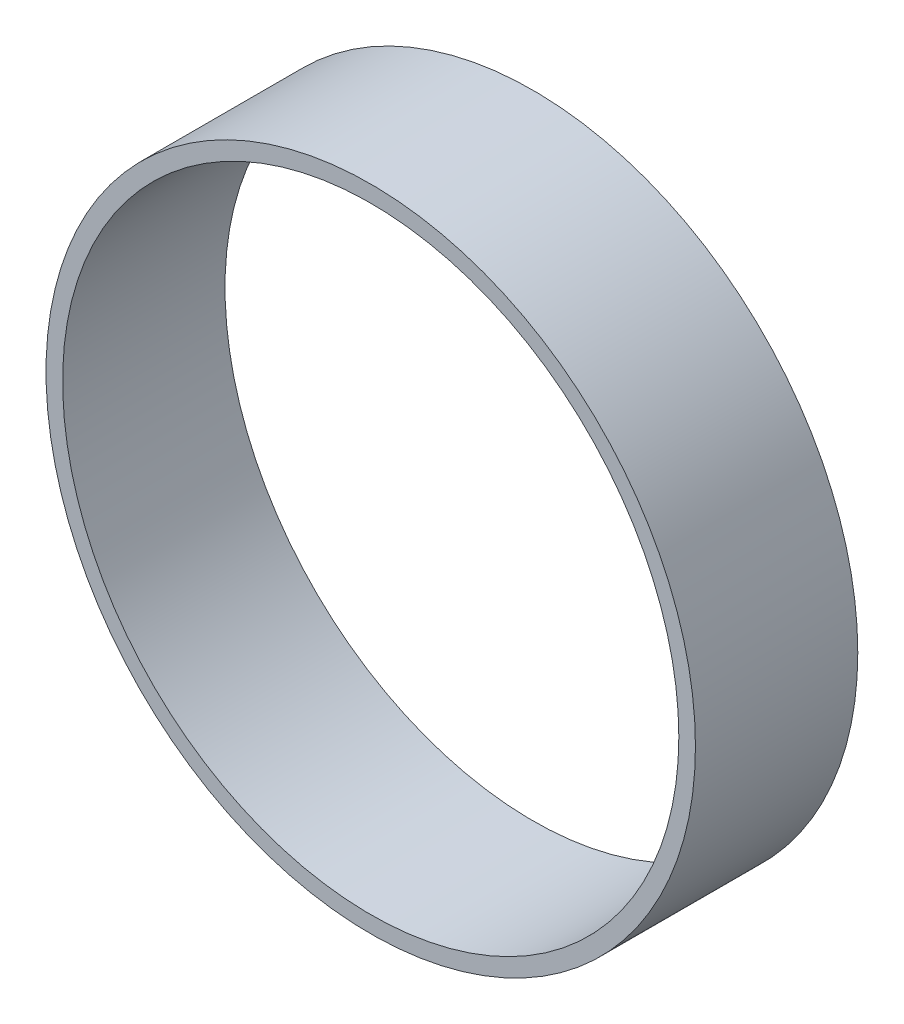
SolidWorks part; units mm, degrees
ref_plane "Front Plane" through (0, 0, 0) normal (0, 0, 1) x (1, 0, 0)
ref_plane "Top Plane" through (0, 0, 0) normal (0, 1, 0) x (1, 0, 0)
ref_plane "Right Plane" through (0, 0, 0) normal (1, 0, 0) x (0, 0, -1)
other "Configuration Table"
sketch "Sketch1" plane through (0, 0, 0) normal (0, 0, 1) x (1, 0, 0)
  circle A0 centre (0, 0) radius 48.2
  circle A1 centre (0, 0) radius 50.8
  dimension "Out_dia" = 101.6
  dimension "Thickness" = 2.6
extrude "BaseSection" add sketch "Sketch1" along normal mid plane 25.4
